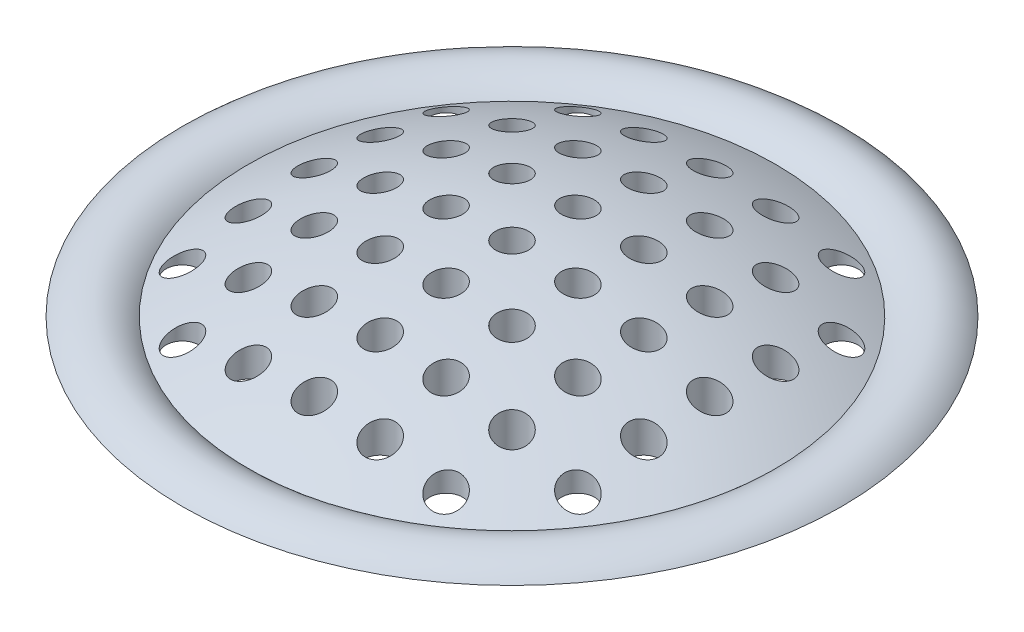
SolidWorks part; units mm, degrees
ref_plane "Piano frontale" through (0, 0, 0) normal (0, 0, 1) x (1, 0, 0)
ref_plane "Piano superiore" through (0, 0, 0) normal (0, 1, 0) x (1, 0, 0)
ref_plane "Piano destro" through (0, 0, 0) normal (1, 0, 0) x (0, 0, -1)
sketch "Schizzo1" plane through (0, 0, 0) normal (0, 0, 1) x (1, 0, 0)
  line L0 (-10, 0) -> (0, 0) construction
  line L1 (0, 0) -> (10, 0) construction
  line L2 (0, 0) -> (0, 2) construction
  line L3 (-10, 0) -> (0, 0)
  line L4 (0, 0) -> (0, 2)
  arc A0 (-10, 0) -> (-8, 0) centre (-9, -1) cw
  arc A1 (-8, 0) -> (0, 2) centre (0, -15) cw
  dimension "D1" = 20
  dimension "D2" = 2
  dimension "D3" = 1
  dimension "D4" = 2
revolve "Rivoluzione1" add sketch "Schizzo1" angle 360 about L4
sketch "Schizzo2" plane through (0, 0, 0) normal (0, 1, 0) x (1, 0, 0)
  line L0 (0, 0) -> (-10, 0) construction
  circle A0 centre (0, 0) radius 10 construction
  circle A24 centre (-4, 6) radius 0.5
  circle A25 centre (-2, 6) radius 0.5
  circle A26 centre (0, 6) radius 0.5
  circle A27 centre (2, 6) radius 0.5
  circle A28 centre (4, 6) radius 0.5
  circle A33 centre (-6, 4) radius 0.5
  circle A34 centre (-4, 4) radius 0.5
  circle A35 centre (-2, 4) radius 0.5
  circle A36 centre (0, 4) radius 0.5
  circle A37 centre (2, 4) radius 0.5
  circle A38 centre (4, 4) radius 0.5
  circle A39 centre (6, 4) radius 0.5
  circle A43 centre (-6, 2) radius 0.5
  circle A44 centre (-4, 2) radius 0.5
  circle A45 centre (-2, 2) radius 0.5
  circle A46 centre (0, 2) radius 0.5
  circle A47 centre (2, 2) radius 0.5
  circle A48 centre (4, 2) radius 0.5
  circle A49 centre (6, 2) radius 0.5
  circle A53 centre (-6, 0) radius 0.5
  circle A54 centre (-4, 0) radius 0.5
  circle A55 centre (-2, 0) radius 0.5
  circle A56 centre (0, 0) radius 0.5
  circle A57 centre (2, 0) radius 0.5
  circle A58 centre (4, 0) radius 0.5
  circle A59 centre (6, 0) radius 0.5
  circle A63 centre (-6, -2) radius 0.5
  circle A64 centre (-4, -2) radius 0.5
  circle A65 centre (-2, -2) radius 0.5
  circle A66 centre (0, -2) radius 0.5
  circle A67 centre (2, -2) radius 0.5
  circle A68 centre (4, -2) radius 0.5
  circle A69 centre (6, -2) radius 0.5
  circle A73 centre (-6, -4) radius 0.5
  circle A74 centre (-4, -4) radius 0.5
  circle A75 centre (-2, -4) radius 0.5
  circle A76 centre (0, -4) radius 0.5
  circle A77 centre (2, -4) radius 0.5
  circle A78 centre (4, -4) radius 0.5
  circle A79 centre (6, -4) radius 0.5
  circle A84 centre (-4, -6) radius 0.5
  circle A85 centre (-2, -6) radius 0.5
  circle A86 centre (0, -6) radius 0.5
  circle A87 centre (2, -6) radius 0.5
  circle A88 centre (4, -6) radius 0.5
extrude "Taglio-Estrusione1" cut sketch "Schizzo2" along normal up to next
